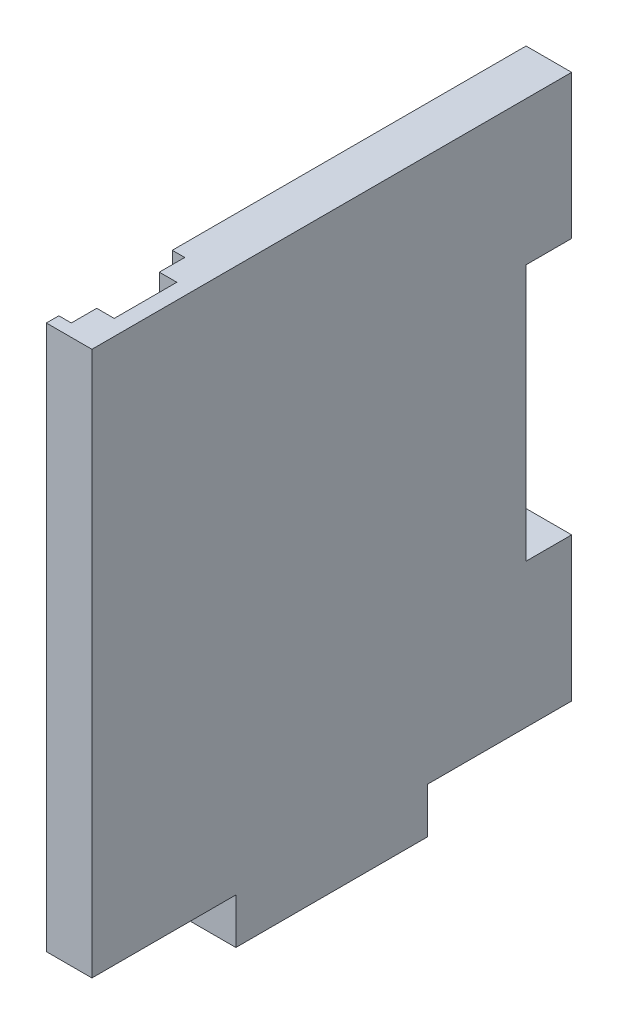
SolidWorks part; units mm, degrees
ref_plane "Plan de face" through (0, 0, 0) normal (0, 0, 1) x (1, 0, 0)
ref_plane "Plan de dessus" through (0, 0, 0) normal (0, 1, 0) x (1, 0, 0)
ref_plane "Plan de droite" through (0, 0, 0) normal (1, 0, 0) x (0, 0, -1)
sketch "Esquisse1" plane through (0, 0, 0) normal (1, 0, 0) x (0, 0, -1)
  line L1 (-100, 123) -> (100, 123)
  line L2 (-100, 123) -> (-100, -123)
  line L3 (-100, -123) -> (100, -123)
  line L4 (100, 123) -> (100, -123)
  line L5 (-100, 123) -> (100, -123) construction
  line L6 (-100, -123) -> (100, 123) construction
  point P0 (0, 0)
  dimension "D1" = 246
  dimension "D2" = 200
extrude "Boss.-Extru.1" add sketch "Esquisse1" along normal mid plane 19
sketch "Esquisse2" plane through (9.5, 0, 0) normal (1, 0, 0) x (0, 0, -1)
  line L0 (100, -123) -> (100, 123) construction
  line L1 (100, 63) -> (81, 63)
  line L2 (100, 63) -> (100, -44)
  line L3 (100, -44) -> (81, -44)
  line L4 (81, 63) -> (81, -44)
  line L5 (100, 123) -> (-100, 123) construction
  line L6 (-100, -123) -> (100, -123) construction
  dimension "D1" = 19
  dimension "D2" = 60
  dimension "D3" = 79
extrude "Enlèv. mat.-Extru.1" cut sketch "Esquisse2" against normal up to next
sketch "Esquisse3" plane through (9.5, 0, 0) normal (1, 0, 0) x (0, 0, -1)
  line L0 (81, -44) -> (100, -44) construction
  line L1 (100, -123) -> (40, -123)
  line L2 (100, -123) -> (100, -104)
  line L3 (100, -104) -> (40, -104)
  line L4 (40, -123) -> (40, -104)
  dimension "D1" = 60
extrude "Enlèv. mat.-Extru.2" cut sketch "Esquisse3" against normal up to next
mirror "Symétrie1" about plane through (0, 0, 0) normal (0, 0, 1) of "Enlèv. mat.-Extru.2"
sketch "Esquisse4" plane through (-9.5, 0, 0) normal (-1, 0, 0) x (0, 0, 1)
  line L0 (-100, 123) -> (100, 123) construction
  line L1 (47.5, 123) -> (94.8, 123)
  line L2 (47.5, 123) -> (47.5, -104)
  line L3 (47.5, -104) -> (94.8, -104)
  line L4 (94.8, 123) -> (94.8, -104)
  line L5 (40, -104) -> (100, -104) construction
  line L6 (100, 123) -> (100, -104) construction
  dimension "D1" = 5.2
  dimension "D2" = 47.3
extrude "Enlèv. mat.-Extru.3" cut sketch "Esquisse4" against normal blind 5.2
sketch "Esquisse5" plane through (-9.5, 0, 0) normal (-1, 0, 0) x (0, 0, 1)
  line L0 (94.8, 123) -> (47.5, 123) construction
  line L1 (84.2, 123) -> (58.1, 123)
  line L2 (84.2, 123) -> (84.2, -104)
  line L3 (84.2, -104) -> (58.1, -104)
  line L4 (58.1, 123) -> (58.1, -104)
  line L5 (47.5, -104) -> (94.8, -104) construction
  line L6 (100, 123) -> (100, -104) construction
  dimension "D1" = 26.1
  dimension "D2" = 15.8
extrude "Enlèv. mat.-Extru.4" cut sketch "Esquisse5" against normal blind 12.5
